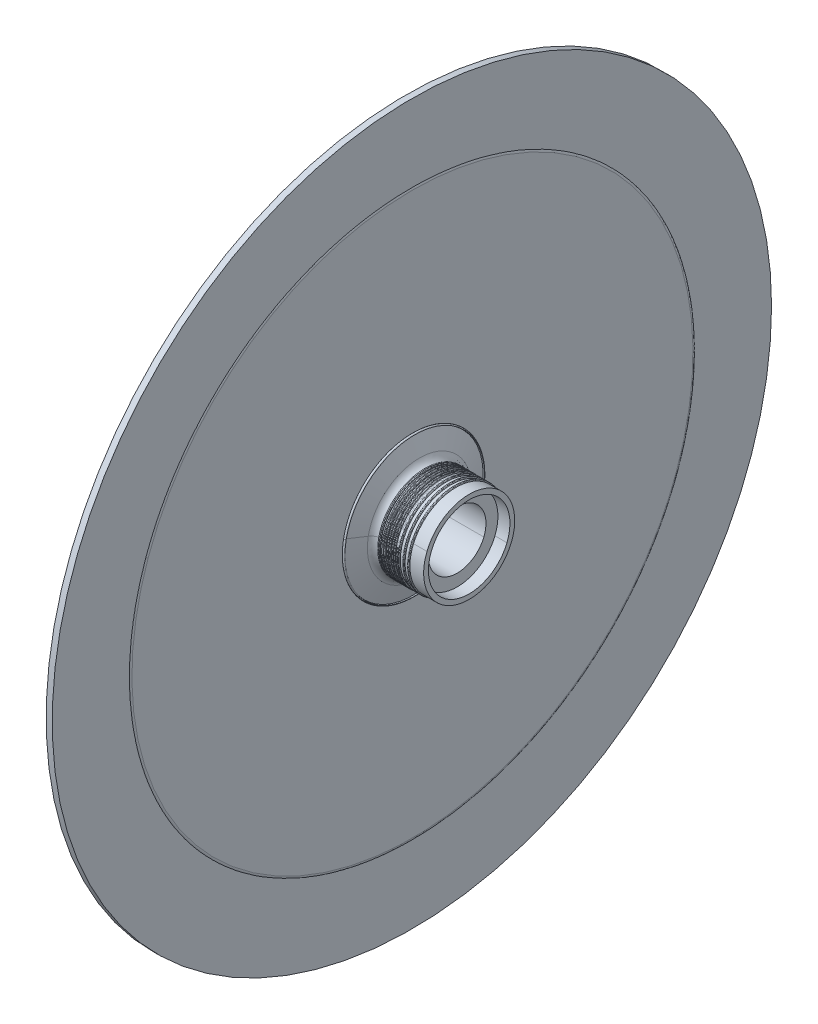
SolidWorks part; units mm, degrees
ref_plane "Alzado" through (0, 0, 0) normal (0, 0, 1) x (1, 0, 0)
ref_plane "Planta" through (0, 0, 0) normal (0, 1, 0) x (1, 0, 0)
ref_plane "Vista lateral" through (0, 0, 0) normal (1, 0, 0) x (0, 0, -1)
imported_body "A1223.IGS<1>"
delete or keep bodies "Sólido-Eliminar/Conservar 1" type delete bodies bodies 106
ref_plane "Plano1" through (70, 0, 0) normal (1, 0, 0) x (0, 0, -1)
sketch "Croquis2" plane through (70, 0, 0) normal (1, 0, 0) x (0, 0, -1)
  circle A0 centre (13.6251, -11.4202) radius 149.987
  dimension "D1" = 299.974
extrude "Saliente-Extruir1" add sketch "Croquis2" against normal blind 2.54
